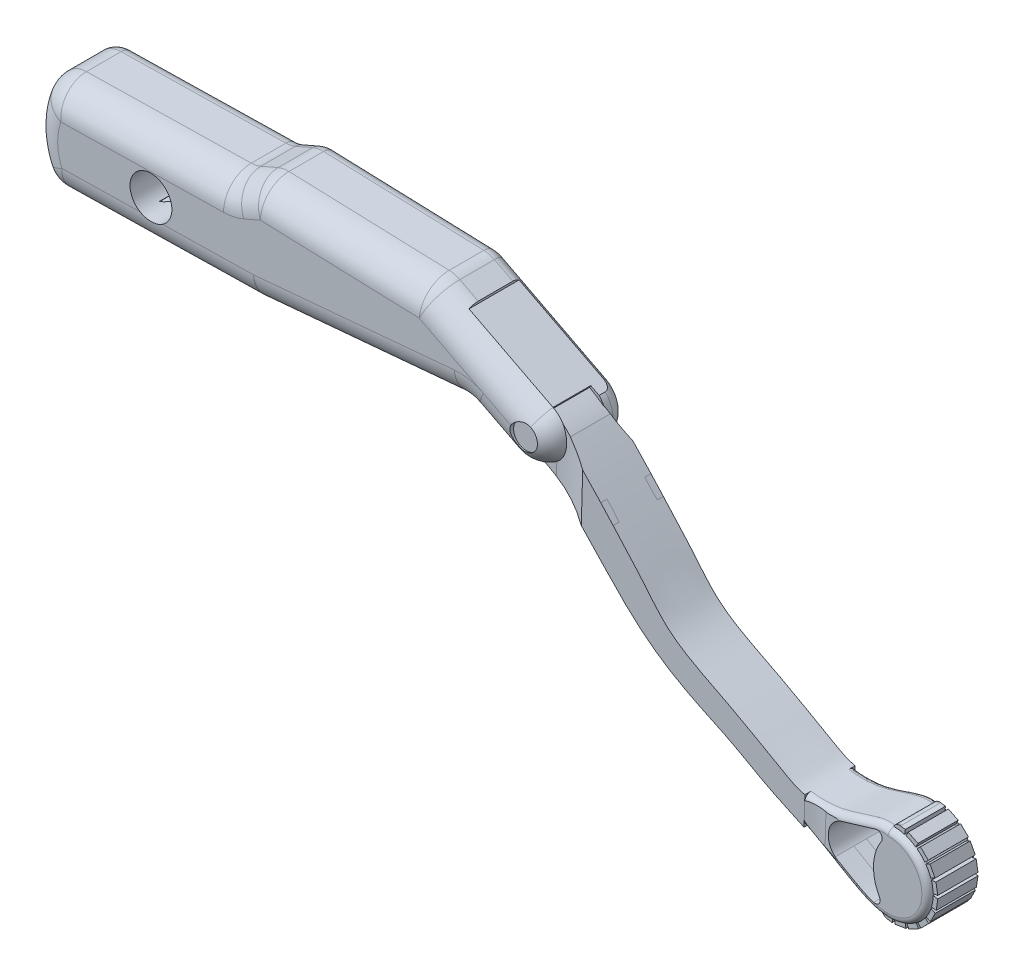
SolidWorks part; units mm, degrees
ref_plane "Front Plane" through (0, 0, 0) normal (0, 0, 1) x (1, 0, 0)
ref_plane "Top Plane" through (0, 0, 0) normal (0, 1, 0) x (1, 0, 0)
ref_plane "Right Plane" through (0, 0, 0) normal (1, 0, 0) x (0, 0, -1)
imported_body "upperLeg-1-solid1"
imported_body "lowerLeg-1-solid1"
sketch "Sketch1" plane through (0, 0, 26.8294) normal (0, 0, 1) x (1, 0, 0)
  line L0 (216.2641, 0.7327) -> (211.6644, 3.1015) construction
  line L1 (216.2641, 0.7327) -> (211.6644, 3.1015)
  line L3 (209.3256, 10.7647) -> (210.0235, 3.4224) construction
  line L4 (209.3256, 10.7647) -> (210.0235, 3.4224)
  line L5 (213.1256, 9.4406) -> (209.3256, 10.7647)
  line L6 (213.1256, 9.4406) -> (218.3613, 0.4044)
  arc A0 (211.6644, 3.1015) -> (210.0235, 3.4224) centre (210.2909, 0.4344) ccw construction
  arc A1 (211.6644, 3.1015) -> (210.0235, 3.4224) centre (210.2909, 0.4344) ccw
  arc A2 (216.2641, 0.7327) -> (220.2594, 6.0432) centre (217.8075, 3.7297) ccw construction
  arc A3 (216.2641, 0.7327) -> (218.3613, 0.4044) centre (217.8075, 3.7297) ccw
  spline S0 degree 3 poles (219.6679, -0.3533) (219.3879, -0.184) (217.9148, 0.6784) (215.1497, 2.1174) (212.6147, 3.2856) (211.3992, 4.0054) knots 0.274496 0.274496 0.274496 0.274496 0.350646 0.671543 1 1 1 1 construction
  dimension "D1" = 3.8
extrude "Boss-Extrude2" add sketch "Sketch1" along normal up to surface (4.5 mm away)
